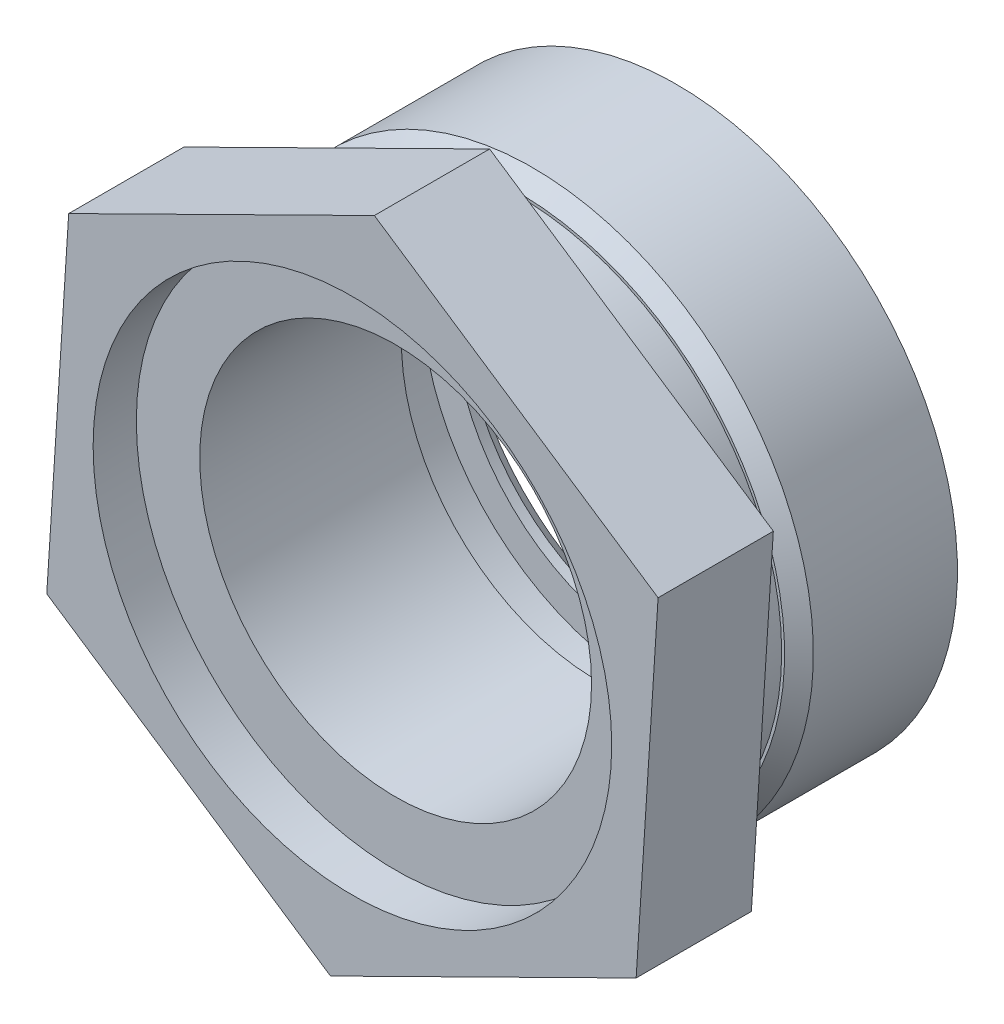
SolidWorks part; units mm, degrees
ref_plane "Plan1" through (0, 0, 0) normal (0, 0, 1) x (1, 0, 0)
ref_plane "Plan2" through (0, 0, 0) normal (0, 1, 0) x (1, 0, 0)
ref_plane "Plan3" through (0, 0, 0) normal (1, 0, 0) x (0, 0, -1)
sketch "Esquisse3" plane through (0, 0, 0) normal (0, 0, 1) x (1, 0, 0)
  line L1 (19.6958, -13.1305) -> (21.2192, 10.4918)
  line L2 (21.2192, 10.4918) -> (1.5235, 23.6223)
  line L3 (1.5235, 23.6223) -> (-19.6958, 13.1305)
  line L4 (-19.6958, 13.1305) -> (-21.2192, -10.4918)
  line L5 (-21.2192, -10.4918) -> (-1.5235, -23.6223)
  line L6 (-1.5235, -23.6223) -> (19.6958, -13.1305)
  circle A0 centre (0, 0) radius 20.5 construction
  dimension "D1" = 41
extrude "Base-Extrusion" add sketch "Esquisse3" along normal blind 8
sketch "Esquisse5" plane through (0, 0, 0) normal (0, 1, 0) x (1, 0, 0)
  line L0 (0, 10) -> (0, -20) construction
  line L1 (0, 3.5) -> (0, 0)
  line L2 (21.2192, 0) -> (1.5235, 0) construction
  line L3 (0, 3.5) -> (-18.3, 3.5)
  line L4 (-18.3, 1.2) -> (-18.3, 3.5)
  line L5 (-21.2192, 0) -> (-1.5235, 0) construction
  line L6 (-18.3, 1.2) -> (-19.5, 0)
  line L7 (0, 0) -> (-19.5, 0)
  dimension "D2" = 3.5
  dimension "D3" = 18.3
  dimension "D4" = 45
revolve "Boss.-Révol.1" add sketch "Esquisse5" angle 360 about L0
sketch "Esquisse6" plane through (0, 0, -3.5) normal (0, 0, -1) x (-1, 0, 0)
  circle A0 centre (0, 0) radius 19.5
  dimension "D1" = 39
extrude "Boss.-Extru.2" add sketch "Esquisse6" along normal blind 11
chamfer "Chanfrein1" distance 1 angle 45
sketch "Esquisse7" plane through (0, 0, 8) normal (0, 0, 1) x (1, 0, 0)
  circle A0 centre (0, 0) radius 18
  dimension "D1" = 36
extrude "Enlèv. mat.-Extru.1" cut sketch "Esquisse7" against normal blind 3
sketch "Esquisse8" plane through (0, 0, 5) normal (0, 0, 1) x (1, 0, 0)
  circle A0 centre (0, 0) radius 13.6
  dimension "D1" = 27.2
extrude "Enlèv. mat.-Extru.2" cut sketch "Esquisse8" against normal through all
chamfer "Chanfrein2" distance 1.2 angle 45
sketch "Esquisse9" plane through (0, 0, 0) normal (0, 1, 0) x (1, 0, 0)
  line L0 (-15.8, 9) -> (0, 9)
  line L3 (-18, -5) -> (18, -5) construction
  line L4 (-15.8, 12.6) -> (0, 12.6)
  line L5 (-15.8, 12.6) -> (-15.8, 9)
  line L6 (0, 14.5) -> (0, 4.5) construction
  line L7 (0, 16.5469) -> (0, -12.1192) construction
  line L8 (0, 12.6) -> (0, 9)
  dimension "D1" = 14
  dimension "D2" = 3.6
  dimension "D3" = 15.8
revolve "Enlèvement de matière-Révolution1" cut sketch "Esquisse9" angle 360 about L7
fillet "Congé2" radius 0.2
